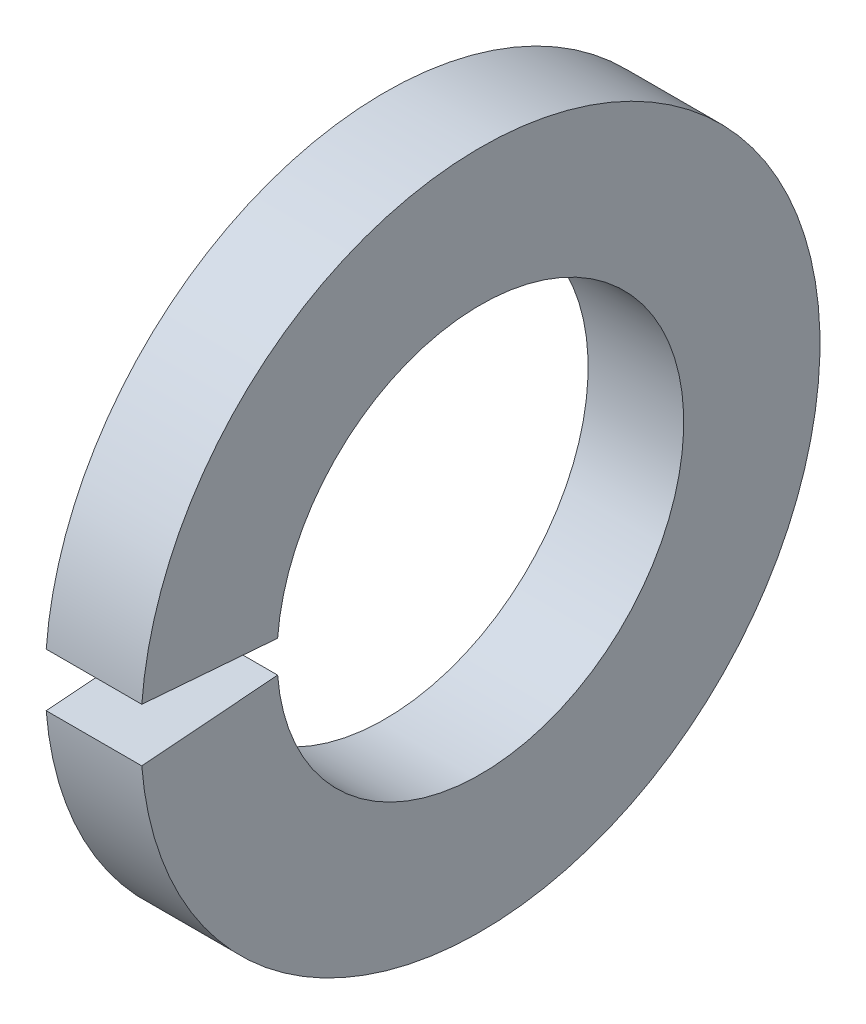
SolidWorks part; units mm, degrees
ref_plane "Plane1" through (0, 0, 0) normal (0, 0, 1) x (1, 0, 0)
ref_plane "Plane2" through (0, 0, 0) normal (0, 1, 0) x (1, 0, 0)
ref_plane "Plane3" through (0, 0, 0) normal (1, 0, 0) x (0, 0, -1)
sketch "Sketch1" plane through (0, 0, 0) normal (0, 0, 1) x (1, 0, 0)
  line L0 (-34.925, 0) -> (9.525, 0) construction
  line L1 (0, 2.54) -> (0, 4.2418)
  line L2 (0, 4.2418) -> (-1.1938, 4.2418)
  line L3 (-1.1938, 4.2418) -> (-1.1938, 2.54)
  line L4 (-1.1938, 2.54) -> (0, 2.54)
  dimension "Thickness" = 1.1938
  dimension "Inside_dia" = 5.08
  dimension "Outside_dia" = 8.4836
revolve "Base-Revolve" add sketch "Sketch1" angle 360 about L0
sketch "Sketch2" plane through (0, 0, 0) normal (-1, 0, 0) x (0, -1, 0)
  line L0 (0, 0) -> (0.3395, 4.3133)
  line L1 (0, -3.175) -> (0, 12.7) construction
  line L2 (0, 0) -> (-0.3395, 4.3133)
  arc A0 (0.3395, 4.3133) -> (-0.3395, 4.3133) centre (0, 0) ccw
  dimension "D1" = 4.3266
  dimension "Gap_ang" = 9
extrude "Gap" cut sketch "Sketch2" along normal through all
equation "\"D1@Sketch2\" = \"Outside_dia@Sketch1\" * 0.51"
